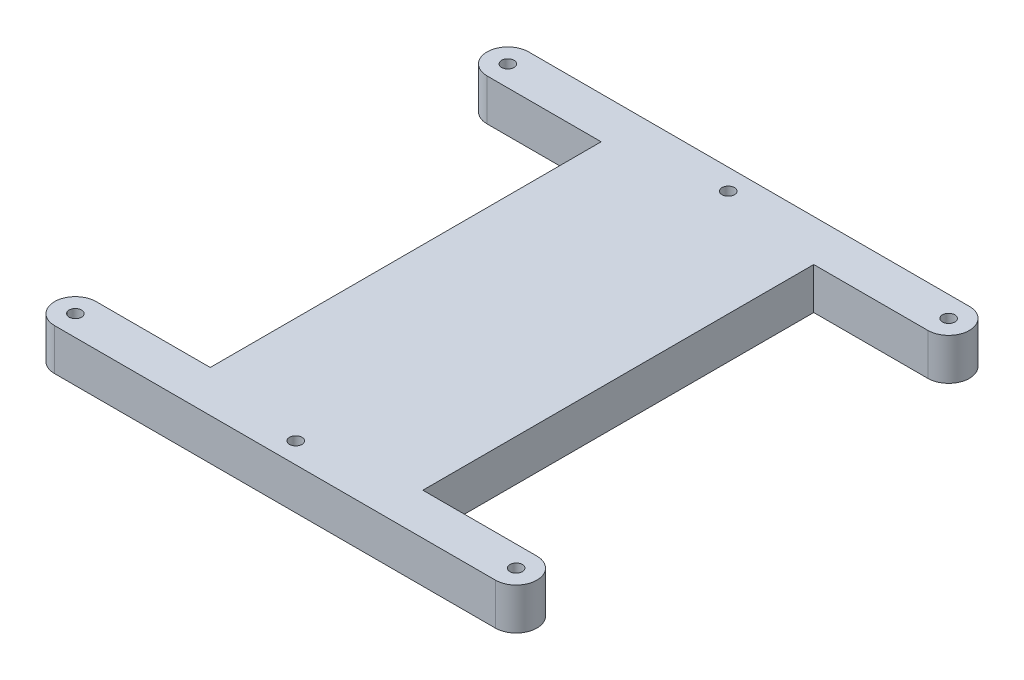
SolidWorks part; units mm, degrees
ref_plane "Vorderseite" through (0, 0, 0) normal (0, 0, 1) x (1, 0, 0)
ref_plane "Oben" through (0, 0, 0) normal (0, 1, 0) x (1, 0, 0)
ref_plane "Rechts" through (0, 0, 0) normal (1, 0, 0) x (0, 0, -1)
ref_plane "Ebene1" through (0, -200, 0) normal (0, 1, 0) x (1, 0, 0)
sketch "Skizze1" plane through (0, -200, 150) normal (0, 1, 0) x (1, 0, 0)
  line L1 (-530, -120) -> (-452, -120)
  line L3 (0, 0) -> (0, 2902.3)
  line L4 (0, 0) -> (0, -120)
  line L5 (0, -120) -> (0, -32.5)
  line L6 (0, -32.5) -> (-126, -32.5)
  line L7 (-530, 0) -> (530, 0) construction
  line L8 (530, 150) -> (530, -150)
  line L9 (-530, 150) -> (-530, -150)
  line L10 (530, -120) -> (452, -120)
  line L11 (-452, -120) -> (0, -120)
  line L12 (0, -120) -> (452, -120)
  line L13 (-530, -1040) -> (530, -1040) construction
  line L14 (0, 0) -> (0, -1040) construction
  line L15 (529.9542, -890) -> (530.0458, -1190)
  line L16 (-530.0526, -867.5292) -> (-529.9474, -1212.4708)
  line L17 (-530.0366, -920) -> (-452.0366, -919.9762)
  line L18 (529.9634, -920) -> (451.9634, -920.0238)
  line L19 (-0.0366, -920) -> (0, -1040)
  line L20 (-0.0099, -1007.5) -> (125.9901, -1007.4615)
  line L21 (-126, -32.5) -> (125.9901, -1007.4615)
  line L22 (-452.0366, -919.9762) -> (-0.0366, -920)
  line L23 (-0.0366, -920) -> (451.9634, -920.0238)
  line L24 (0, -1356) -> (0, -1040)
  line L25 (344.7172, -520) -> (0, -520)
  circle A0 centre (0, 0) radius 7.3181
  point P4 (0, 0)
  point P13 (0, 0)
  point P17 (-530, 0)
  point P19 (530, 0)
  point P30 (-530, -1040)
  point P31 (530, -1040)
  dimension "D3" = 2902.3
  dimension "D5" = 32.5
  dimension "D6" = 120
  dimension "D7" = 1060
  dimension "D8" = 78
  dimension "D9" = 120
  dimension "D10" = 120
  dimension "D11" = 452
  dimension "D14" = 300
  dimension "D15" = 1040
  dimension "D16" = 126
  dimension "D17" = 120
  dimension "D18" = 120
  dimension "D19" = 32.5
  dimension "D20" = 1007
  dimension "D21" = 316
sketch "Skizze2" plane through (0, -200, 0) normal (0, 1, 0) x (1, 0, 0)
  line L0 (530, -150) -> (-530, -150) construction
  line L1 (530, -200) -> (-530, -200)
  line L2 (530, -100) -> (-530, -100)
  line L3 (344.7172, -670) -> (0, -670) construction
  line L4 (344.7172, -670) -> (0, -670) construction
  line L5 (530, -1190) -> (-530, -1190) construction
  line L6 (530, -1140) -> (-530, -1140)
  line L7 (530, -1240) -> (-530, -1240)
  circle A0 centre (530, -150) radius 15
  circle A2 centre (-530, -150) radius 15
  arc A3 (530, -200) -> (530, -100) centre (530, -150) ccw
  arc A4 (-530, -100) -> (-530, -200) centre (-530, -150) ccw
  circle A5 centre (-530, -1190) radius 15
  circle A6 centre (530, -1190) radius 15
  arc A7 (530, -1140) -> (530, -1240) centre (530, -1190) cw
  arc A8 (-530, -1240) -> (-530, -1140) centre (-530, -1190) cw
  circle A9 centre (0, -150) radius 15
  circle A10 centre (0, -1190) radius 15
  point P3 (0, -150)
  point P18 (0, -1190)
  dimension "D1" = 30
  dimension "D2" = 30
  dimension "D3" = 50
  dimension "D4" = 30
  dimension "D5" = 30
extrude "Aufsatz-Linear austragen1" add sketch "Skizze2" against normal blind 100
sketch "Skizze4" plane through (0, -200, 0) normal (0, 1, 0) x (1, 0, 0)
  line L1 (255.608, -1153.6516) -> (-255.608, -1153.6516)
  line L2 (255.608, -1153.6516) -> (255.608, -186.3484)
  line L3 (255.608, -186.3484) -> (-255.608, -186.3484)
  line L4 (-255.608, -1153.6516) -> (-255.608, -186.3484)
  line L5 (255.608, -1153.6516) -> (-255.608, -186.3484) construction
  line L6 (255.608, -186.3484) -> (-255.608, -1153.6516) construction
  point P0 (0, -670)
extrude "Aufsatz-Linear austragen2" add sketch "Skizze4" against normal blind 100
